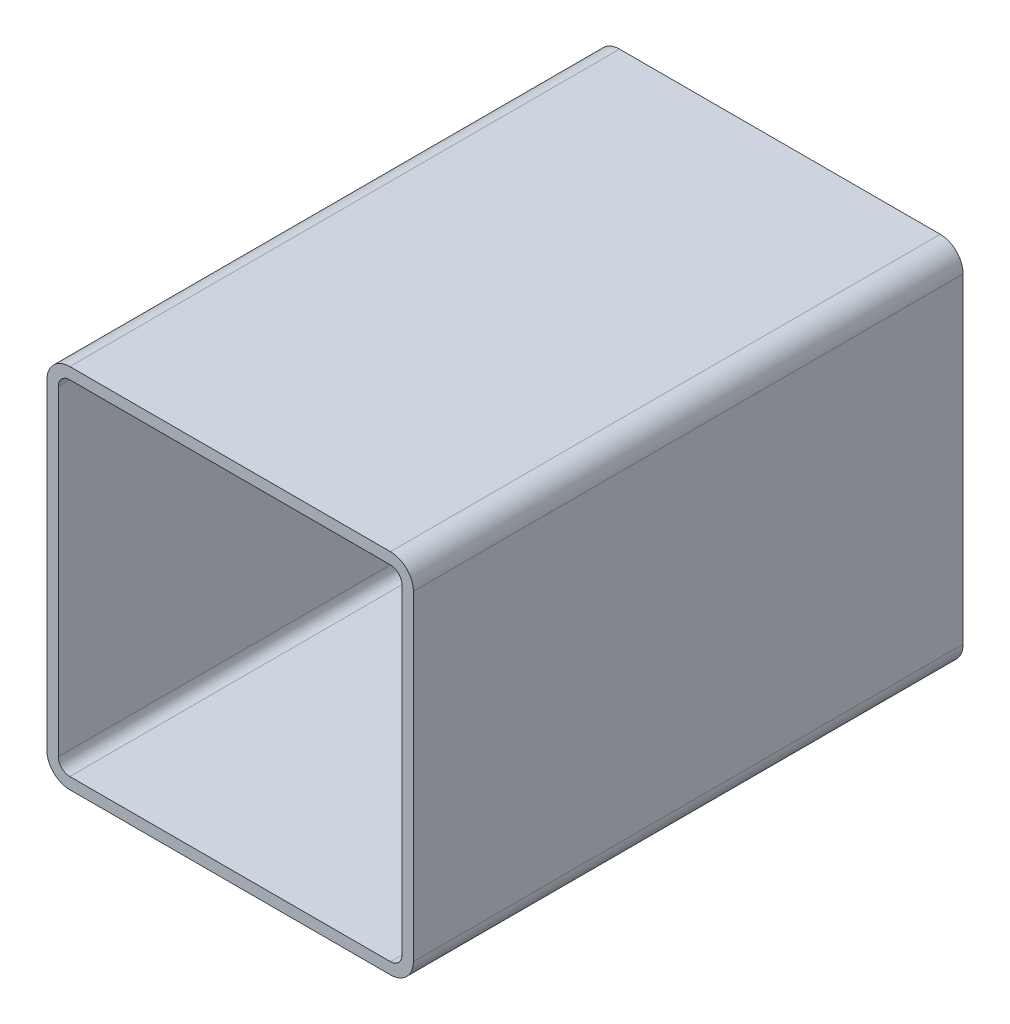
SolidWorks part; units mm, degrees
ref_plane "Front Plane" through (0, 0, 0) normal (0, 0, 1) x (1, 0, 0)
ref_plane "Top Plane" through (0, 0, 0) normal (0, 1, 0) x (1, 0, 0)
ref_plane "Right Plane" through (0, 0, 0) normal (1, 0, 0) x (0, 0, -1)
sketch "Sketch1" plane through (0, 0, 0) normal (0, 0, 1) x (1, 0, 0)
sketch_block_instance "HSS8x8x0.250-1"
sketch_block "HSS8x8x0.250"
extrude "Boss-Extrude1" add sketch "Sketch1" along normal blind 304.8
